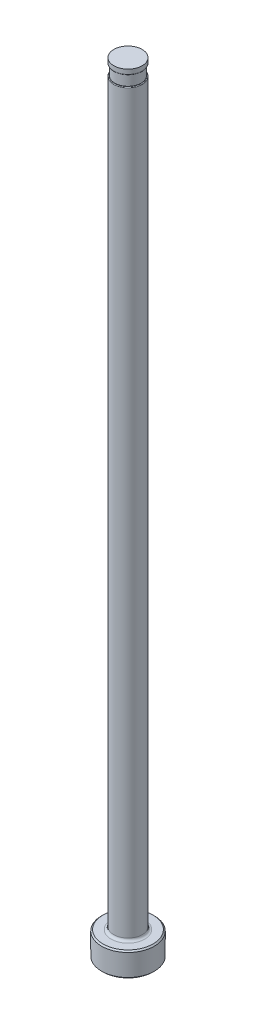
SolidWorks part; units mm, degrees
ref_plane "Front Plane" through (0, 0, 0) normal (0, 0, 1) x (1, 0, 0)
ref_plane "Top Plane" through (0, 0, 0) normal (0, 1, 0) x (1, 0, 0)
ref_plane "Right Plane" through (0, 0, 0) normal (1, 0, 0) x (0, 0, -1)
other "Configuration Table"
sketch "Sketch1" plane through (0, 0, 0) normal (0, 0, 1) x (1, 0, 0)
  line L0 (0, 259.9588) -> (0, -15.1925) construction
  line L1 (0, 0) -> (-5.1562, 0)
  line L2 (-5.1562, 0) -> (-5.1562, 4.7498)
  line L3 (-5.1562, 4.7498) -> (-2.7775, 4.7498)
  line L4 (-2.7775, 4.7498) -> (-2.7775, 152.4)
  line L5 (-2.7775, 152.4) -> (0, 152.4)
  line L6 (0, 152.4) -> (0, 0)
  dimension "L" = 152.4
  dimension "H" = 10.3124
  dimension "T" = 4.7498
  dimension "D" = 5.555
revolve "Revolve1" add sketch "Sketch1" angle 360 about L0
chamfer "Chamfer1" distance 0.254 angle 45 2 edges at (0, 4.7498, 5.1562) (0, 0, 5.1562)
fillet "Fillet1" radius 0.508 1 edges at (0, 4.7498, 2.7775)
sketch "Sketch2" plane through (0, 0, 0) normal (0, 0, 1) x (1, 0, 0)
  line L0 (-2.7775, 152.4) -> (-2.7775, 5.2578) construction
  line L1 (-2.7775, 151.384) -> (-2.5743, 151.384)
  line L2 (-2.7775, 151.384) -> (-2.7775, 149.352)
  line L3 (-2.7775, 149.352) -> (-2.5743, 149.352)
  line L4 (-2.5743, 151.384) -> (-2.5743, 149.352)
  line L5 (2.7775, 152.4) -> (-2.7775, 152.4) construction
  line L6 (0, 153.4483) -> (0, 147.3282) construction
  dimension "D1" = 2.032
  dimension "N" = 1.016
  dimension "FD" = 0.2032
  dimension "D3" = 5.1486
revolve "Vent Relief" cut sketch "Sketch2" angle 360 about L6
sketch "Sketch3" plane through (0, 0, 0) normal (0, 0, 1) x (1, 0, 0)
  line L0 (-2.5743, 150.368) -> (-2.5743, 86.868)
  line L1 (-2.5743, 151.384) -> (-2.5743, 149.352) construction
  line L2 (-2.7775, 149.352) -> (-2.7775, 5.2578) construction
  line L3 (-2.7775, 85.7504) -> (-2.7775, 150.368)
  line L4 (-2.7775, 150.368) -> (-2.5743, 150.368)
  arc A0 (-2.5743, 86.868) -> (-2.7775, 85.7504) centre (-5.7493, 86.868) cw
  dimension "D1" = 3.175
  dimension "D2" = 63.5
extrude "D-Slot" cut sketch "Sketch3" against normal through all both and the other way through all
sketch "Sketch5" plane through (0, 0, 0) normal (0, 0, 1) x (1, 0, 0)
  line L0 (-2.7775, 151.384) -> (2.7775, 151.384) construction
  line L1 (-2.7775, 152.4) -> (-2.7724, 152.4)
  line L2 (-2.7775, 152.4) -> (-2.7775, 151.384)
  line L3 (-2.7775, 151.384) -> (-2.7724, 151.384)
  line L4 (-2.7724, 152.4) -> (-2.7724, 151.384)
  line L5 (0, 152.6877) -> (0, 150.5771) construction
  dimension "VP" = 0.0051
revolve "Vent Diameter" cut sketch "Sketch5" angle 360 about L5
fillet "Fillet2" radius 0.127 2 edges at (2.7775, 149.352, 0) (0, 151.384, 2.7724)
sketch "Pocket Sketch" plane through (0, 0, 0) normal (0, 0, 1) x (1, 0, 0)
  line L0 (-5.5531, 0) -> (-5.5531, 4.7752)
  line L1 (-5.5531, 4.7752) -> (-3.7379, 4.7752)
  line L2 (-2.9759, 5.5372) -> (-2.9759, 22.225)
  line L3 (-2.9759, 22.225) -> (0, 22.225)
  line L4 (0, 22.225) -> (0, 0)
  line L5 (0, 0) -> (-5.5531, 0)
  line L6 (0, 12.6104) -> (0, -2.4989) construction
  line L7 (-5.1562, 4.4958) -> (-5.1562, 0.254) construction
  line L8 (4.9022, 4.7498) -> (-4.9022, 4.7498) construction
  line L9 (-2.7775, 85.7504) -> (-2.7775, 5.2578) construction
  line L10 (-3.7379, 4.7752) -> (-2.9759, 5.5372)
  point P3 (-2.9759, 4.7752)
  dimension "D1" = 11.1061
  dimension "D2" = 0.3969
  dimension "D3" = 0.0254
  dimension "D4" = 0.1984
  dimension "D5" = 5.9519
  dimension "D6" = 22.225
